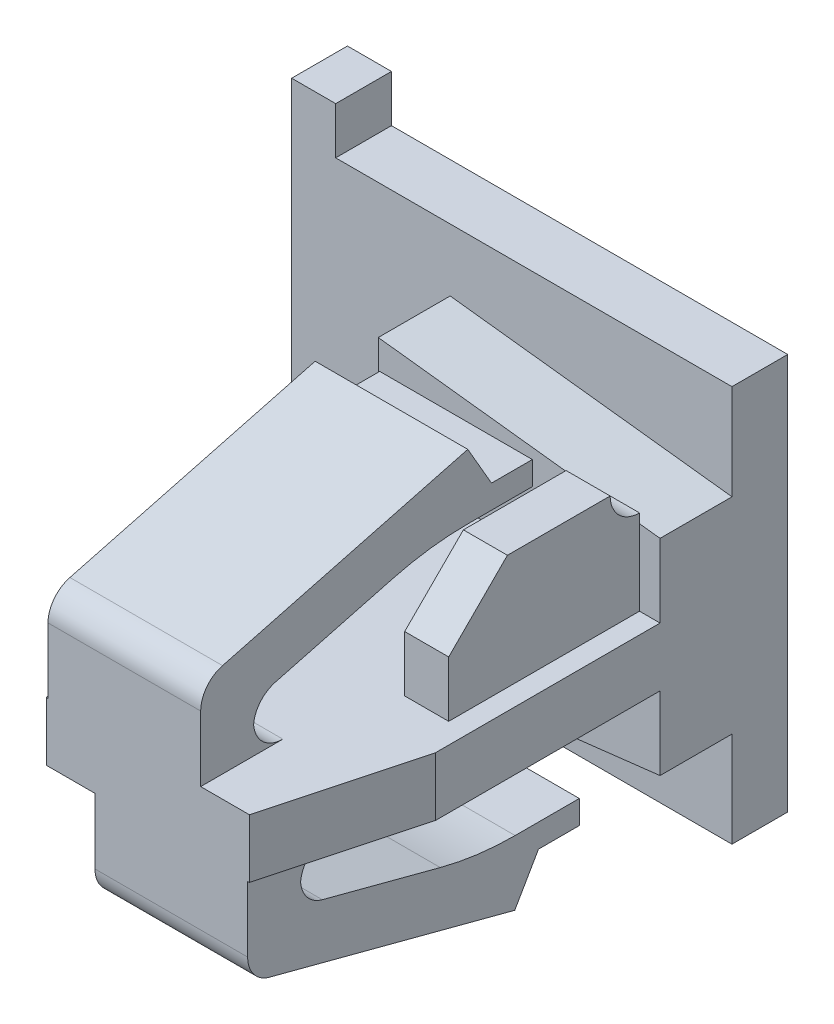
SolidWorks part; units mm, degrees
ref_plane "Front Plane" through (0, 0, 0) normal (0, 0, 1) x (1, 0, 0)
ref_plane "Top Plane" through (0, 0, 0) normal (0, 1, 0) x (1, 0, 0)
ref_plane "Right Plane" through (0, 0, 0) normal (1, 0, 0) x (0, 0, -1)
sketch "Sketch1" plane through (0, 0, 0) normal (0, 0, 1) x (1, 0, 0)
  line L1 (0, 0) -> (15, 0)
  line L2 (0, 0) -> (0, 13.5)
  line L3 (0, 13.5) -> (15, 13.5)
  line L4 (15, 0) -> (15, 13.5)
  dimension "D1" = 15
  dimension "D2" = 13.5
extrude "Boss-Extrude1" add sketch "Sketch1" along normal blind 17
sketch "Sketch2" plane through (0, 0, 17) normal (0, 0, 1) x (1, 0, 0)
  line L0 (15, 6.75) -> (0, 6.75) construction
  line L1 (15, 0) -> (15, 13.5) construction
  line L2 (0, -53.1855) -> (0, 53.1855) construction
  line L4 (5.4, 0.5) -> (15, 0.5)
  line L5 (5.4, 0.5) -> (5.4, 13)
  line L6 (5.4, 13) -> (15, 13)
  line L7 (15, 0.5) -> (15, 13)
  line L8 (5.4, 0.5) -> (15, 13) construction
  line L9 (5.4, 13) -> (15, 0.5) construction
  point P6 (10.2, 6.75)
  dimension "D1" = 9.6
  dimension "D2" = 12.5
extrude "Cut-Extrude1" cut sketch "Sketch2" against normal blind 15.1 flip side to cut
sketch "Sketch5" plane through (15, 0, 0) normal (1, 0, 0) x (0, 0, -1)
  line L0 (-17, 6.75) -> (0, 6.75) construction
  line L1 (-17, 0.5) -> (-17, 13) construction
  line L2 (0, 52.6466) -> (0, -52.6466) construction
  line L3 (-17, 7.75) -> (-4.35, 7.75)
  line L4 (-4.35, 7.75) -> (-4.35, 11.375)
  line L5 (-1.9, 13) -> (-1.9, 11.375)
  line L6 (-1.9, 11.375) -> (-4.35, 11.375)
  line L7 (-17, 7.75) -> (-17, 13)
  line L8 (-17, 13) -> (-1.9, 13)
  line L9 (-17, 0.5) -> (-1.9, 0.5)
  line L10 (-17, 5.75) -> (-17, 0.5)
  line L11 (-1.9, 2.125) -> (-4.35, 2.125)
  line L12 (-1.9, 0.5) -> (-1.9, 2.125)
  line L13 (-4.35, 5.75) -> (-4.35, 2.125)
  line L14 (-17, 5.75) -> (-4.35, 5.75)
  dimension "D1" = 4.625
  dimension "D2" = 4.35
  dimension "D3" = 1
extrude "Cut-Extrude2" cut sketch "Sketch5" against normal through all
sketch "Sketch7" plane through (15, 0, 0) normal (1, 0, 0) x (0, 0, -1)
  line L0 (-17, 7.75) -> (-17, 10.75)
  line L1 (-17, 10.75) -> (-7.9, 13.15)
  line L3 (-7.0917, 11.75) -> (-5.7, 11.75)
  line L4 (-5.7, 11.75) -> (-5.7, 10.95)
  line L6 (-15.2, 9.3632) -> (-15.2, 7.75)
  line L7 (-17, 7.75) -> (-4.35, 7.75) construction
  line L8 (-15.2, 7.75) -> (-17, 7.75)
  line L9 (-17, 6.75) -> (0, 6.75) construction
  line L10 (-17, 5.75) -> (-17, 7.75) construction
  line L11 (0, 52.6466) -> (0, -52.6466) construction
  line L12 (-1.9, 11.375) -> (-1.9, 13.5) construction
  line L13 (-15.2, 9.3632) -> (-9.1833, 10.95)
  line L14 (-9.1833, 10.95) -> (-5.7, 10.95)
  line L15 (-7.9, 13.15) -> (-7.0917, 11.75)
  line L16 (-4.35, 7.75) -> (-4.35, 11.375) construction
  line L17 (-15.2, 4.1368) -> (-15.2, 5.75)
  line L18 (-15.2, 5.75) -> (-17, 5.75)
  line L19 (-17, 5.75) -> (-17, 2.75)
  line L20 (-17, 2.75) -> (-7.9, 0.35)
  line L21 (-5.7, 1.75) -> (-5.7, 2.55)
  line L22 (-7.0917, 1.75) -> (-5.7, 1.75)
  line L23 (-7.9, 0.35) -> (-7.0917, 1.75)
  line L24 (-15.2, 4.1368) -> (-9.1833, 2.55)
  line L25 (-9.1833, 2.55) -> (-5.7, 2.55)
  dimension "D1" = 6.4
  dimension "D2" = 3.8
  dimension "D3" = 1.8
  dimension "D4" = 1.8
  dimension "D5" = 3
  dimension "D6" = 0.8
  dimension "D7" = 30
  dimension "D8" = 6
  dimension "D9" = 5
extrude "Boss-Extrude2" add sketch "Sketch7" against normal up to surface (9.6 mm away)
sketch "Sketch8" plane through (0, 0, 17) normal (0, 0, 1) x (1, 0, 0)
  line L0 (15, 6.75) -> (0, 6.75) construction
  line L1 (15, 2.75) -> (15, 10.75) construction
  line L2 (0, -53.1855) -> (0, 53.1855) construction
  line L3 (15, 7.75) -> (12, 7.75)
  line L4 (12, 7.75) -> (12, 13.15)
  line L5 (5.4, 13.15) -> (15, 13.15) construction
  line L6 (12, 13.15) -> (15, 13.15)
  line L7 (15, 13.15) -> (15, 7.75)
  line L8 (5.4, 13.15) -> (5.4, 7.75)
  line L9 (5.4, 10.75) -> (5.4, 2.75) construction
  line L10 (5.4, 7.75) -> (6.8, 7.75)
  line L11 (6.8, 7.75) -> (6.8, 13.15)
  line L12 (6.8, 13.15) -> (5.4, 13.15)
  line L13 (5.4, 0.35) -> (15, 0.35) construction
  line L14 (15, 5.75) -> (13.6, 5.75)
  line L15 (15, 5.75) -> (15, 0.35)
  line L16 (15, 0.35) -> (13.6, 0.35)
  line L17 (13.6, 5.75) -> (13.6, 0.35)
  line L18 (5.4, 11.375) -> (5.4, 2.125) construction
  line L19 (5.4, 5.75) -> (8.4, 5.75)
  line L20 (5.4, 5.75) -> (5.4, 0.35)
  line L21 (5.4, 0.35) -> (8.4, 0.35)
  line L22 (8.4, 5.75) -> (8.4, 0.35)
  dimension "D1" = 1.4
  dimension "D2" = 1
  dimension "D3" = 3
  dimension "D4" = 1
  dimension "D5" = 3
  dimension "D6" = 1.4
  dimension "D7" = 1
  dimension "D8" = 1
extrude "Cut-Extrude3" cut sketch "Sketch8" against normal up to surface (12.65 mm away)
sketch "Sketch9" plane through (0, 0, 4.35) normal (0, 0, 1) x (1, 0, 0)
  line L0 (5.4, 11.375) -> (15, 11.375)
  line L1 (15, 11.375) -> (15, 10.25)
  line L2 (15, 7.75) -> (15, 11.375) construction
  line L3 (15, 10.25) -> (5.4, 11.375)
  line L4 (15, 6.75) -> (0, 6.75) construction
  line L5 (15, 5.75) -> (15, 7.75) construction
  line L6 (0, -53.1855) -> (0, 53.1855) construction
  line L7 (15, 3.25) -> (5.4, 2.125)
  line L8 (15, 2.125) -> (15, 3.25)
  line L9 (5.4, 2.125) -> (15, 2.125)
  dimension "D1" = 3.5
extrude "Cut-Extrude4" cut sketch "Sketch9" against normal up to surface (2.45 mm away)
sketch "Sketch10" plane through (0, 0, 4.35) normal (0, 0, 1) x (1, 0, 0)
  line L0 (5.4, 5.75) -> (15, 5.75) construction
  line L1 (6.1, 5.75) -> (7.6, 5.75)
  line L2 (6.1, 5.75) -> (6.1, 1.85)
  line L3 (6.1, 1.85) -> (7.6, 1.85)
  line L4 (7.6, 5.75) -> (7.6, 1.85)
  line L5 (12, 7.75) -> (15, 7.75) construction
  line L6 (14.3, 7.75) -> (12.8, 7.75)
  line L7 (14.3, 7.75) -> (14.3, 11.65)
  line L8 (14.3, 11.65) -> (12.8, 11.65)
  line L9 (12.8, 7.75) -> (12.8, 11.65)
  line L10 (5.4, 11.375) -> (5.4, 2.125) construction
  line L11 (15, 7.75) -> (15, 10.25) construction
  line L12 (8.4, 5.75) -> (5.4, 5.75) construction
  dimension "D1" = 0.7
  dimension "D2" = 0.7
  dimension "D3" = 3.9
  dimension "D4" = 3.9
  dimension "D5" = 1.5
  dimension "D6" = 1.5
extrude "Boss-Extrude3" add sketch "Sketch10" along normal blind 6.5
sketch "Sketch12" plane through (14.3, 0, 0) normal (1, 0, 0) x (0, 0, -1)
  line L0 (-5.35, 11.65) -> (-4.35, 11.65)
  line L1 (-4.35, 11.65) -> (-4.35, 10.65)
  arc A0 (-5.35, 11.65) -> (-4.35, 10.65) centre (-4.35, 11.65) ccw
  dimension "D1" = 2
extrude "Cut-Extrude5" cut sketch "Sketch12" against normal up to surface (1.5 mm away)
sketch "Sketch13" plane through (6.1, 0, 0) normal (-1, 0, 0) x (0, 0, 1)
  line L0 (4.35, 1.85) -> (5.35, 1.85)
  line L1 (4.35, 1.85) -> (4.35, 2.85)
  arc A0 (5.35, 1.85) -> (4.35, 2.85) centre (4.35, 1.85) ccw
  dimension "D1" = 2
extrude "Cut-Extrude6" cut sketch "Sketch13" against normal up to surface (1.5 mm away)
fillet "Fillet1" radius 1 6 edges at (11, 4.1368, 15.2) (11, 5.75, 15.2) (9.4, 7.75, 15.2) (9.4, 9.3632, 15.2) (9.4, 10.75, 17) (11, 2.75, 17)
fillet "Fillet2" radius 10 2 edges at (11, 2.55, 9.1833) (9.4, 10.95, 9.1833)
chamfer "Chamfer1" distance 2 angle 45 2 edges at (6.85, 1.85, 10.85) (13.55, 11.65, 10.85)
sketch "Sketch14" plane through (0, 0, 1.9) normal (0, 0, 1) x (1, 0, 0)
  line L0 (15, 6.75) -> (0, 6.75) construction
  line L1 (15, 5.75) -> (15, 7.75) construction
  line L2 (0, -53.1855) -> (0, 53.1855) construction
  line L3 (15, 13.5) -> (0, 13.5) construction
  line L4 (0, 13.5) -> (1.5, 13.5)
  line L5 (0, 13.5) -> (0, 15.1)
  line L6 (0, 15.1) -> (1.5, 15.1)
  line L7 (1.5, 13.5) -> (1.5, 15.1)
  line L8 (1.5, 0) -> (1.5, -1.6)
  line L9 (0, -1.6) -> (1.5, -1.6)
  line L10 (0, 0) -> (0, -1.6)
  line L11 (0, 0) -> (1.5, 0)
  dimension "D1" = 1.5
  dimension "D2" = 8.35
extrude "Boss-Extrude4" add sketch "Sketch14" against normal up to surface (1.9 mm away)
chamfer "Chamfer2" distance 5 angle 15 2 edges at (15, 6.75, 17) (5.4, 6.75, 17)
